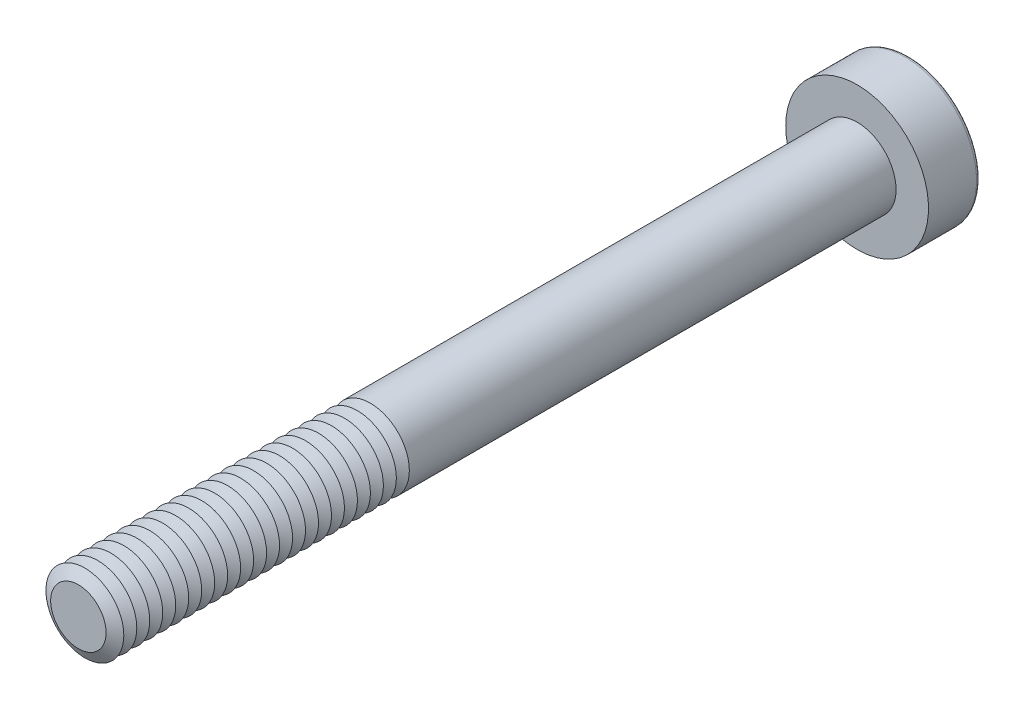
SolidWorks part; units mm, degrees
ref_plane "Front Plane" through (0, 0, 0) normal (0, 0, 1) x (1, 0, 0)
ref_plane "Top Plane" through (0, 0, 0) normal (0, 1, 0) x (1, 0, 0)
ref_plane "Right Plane" through (0, 0, 0) normal (1, 0, 0) x (0, 0, -1)
sketch "Sketch1" plane through (0, 0, 0) normal (0, 0, 1) x (1, 0, 0)
  circle A0 centre (0, 0) radius 1.5
  dimension "D1" = 3
extrude "Boss-Extrude1" add sketch "Sketch1" along normal blind 30
sketch "Sketch2" plane through (0, 0, 0) normal (0, 0, -1) x (-1, 0, 0)
  circle A0 centre (0, 0) radius 2.75
  dimension "D1" = 5.5
extrude "Boss-Extrude2" add sketch "Sketch2" along normal blind 2
sketch "Sketch3" plane through (0, 0, -2) normal (0, 0, -1) x (-1, 0, 0)
  line L1 (-0.5774, 1) -> (-1.1547, 0)
  line L2 (-1.1547, 0) -> (-0.5774, -1)
  line L3 (-0.5774, -1) -> (0.5774, -1)
  line L4 (0.5774, -1) -> (1.1547, 0)
  line L5 (1.1547, 0) -> (0.5774, 1)
  line L6 (0.5774, 1) -> (-0.5774, 1)
  circle A0 centre (0, 0) radius 1 construction
  dimension "D1" = 2
extrude "Cut-Extrude1" cut sketch "Sketch3" against normal blind 1.5
fillet "Fillet1" radius 0.15 1 edges at (-2.75, 0, -2)
sketch "Sketch4" plane through (0, 0, -0.5) normal (0, 0, -1) x (-1, 0, 0)
  line L0 (0.5774, -1) -> (1.1547, 0) construction
  circle A0 centre (0, 0) radius 1
extrude "Cut-Extrude2" cut sketch "Sketch4" against normal through all draft 60
sketch "Sketch5" plane through (0, 0, -2) normal (0, 0, -1) x (-1, 0, 0)
  circle A0 centre (0, 0) radius 1.1547
extrude "Cut-Extrude3" cut sketch "Sketch5" against normal through all draft 75
sketch "Sketch7" plane through (0, 0, 0) normal (1, 0, 0) x (0, 0, -1)
  line L25 (-30, 1.067) -> (-29.75, 1.5)
  line L26 (-30, 1.5) -> (-30, -1.5) construction
  line L27 (-29.75, 1.5) -> (-30.25, 1.5)
  line L28 (-30.25, 1.5) -> (-30, 1.067)
  line L29 (0, 1.5) -> (-30, 1.5) construction
  dimension "D1" = 0.5
revolve "Cut-Revolve1" cut sketch "Sketch7" angle 360 about axis through (0, 0, 30) along (0, 0, -1)
pattern_linear "LPattern1" count 23 spacing 0.5 along (0, 0, -1) of "Cut-Revolve1"
